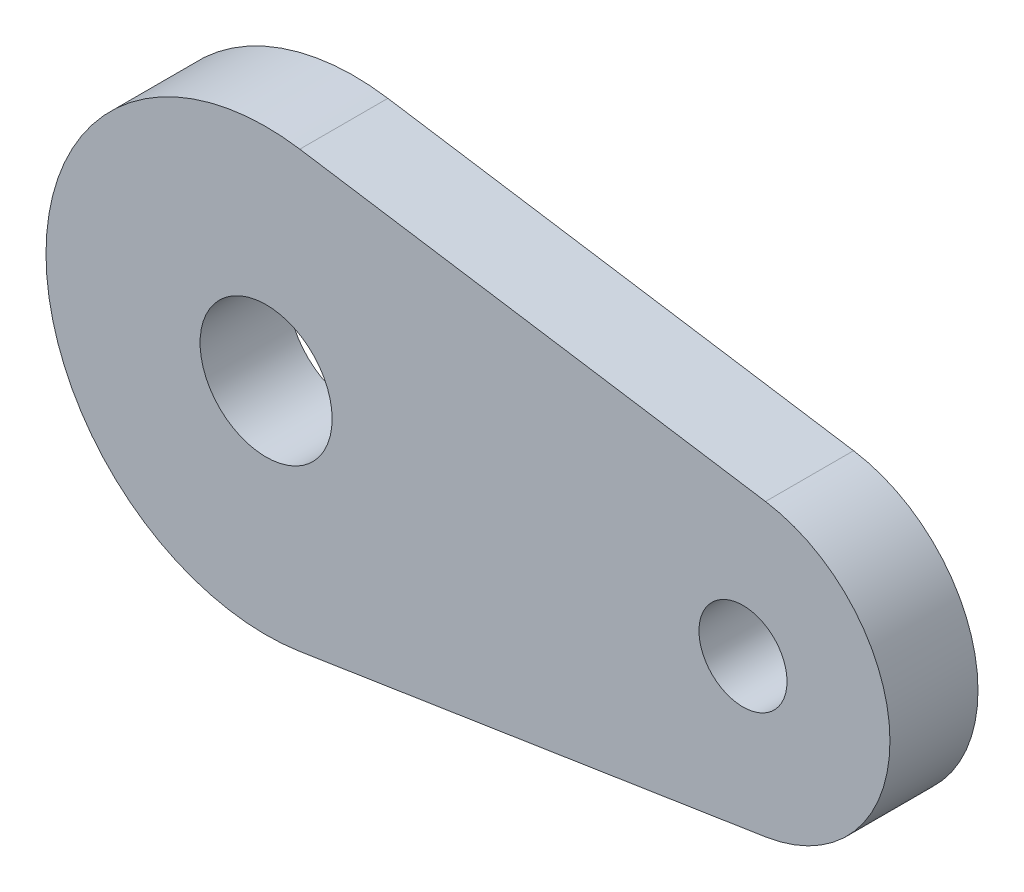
SolidWorks part; units mm, degrees
ref_plane "前视基准面" through (0, 0, 0) normal (0, 0, 1) x (1, 0, 0)
ref_plane "上视基准面" through (0, 0, 0) normal (0, 1, 0) x (1, 0, 0)
ref_plane "右视基准面" through (0, 0, 0) normal (1, 0, 0) x (0, 0, -1)
sketch "草图1" plane through (0, 0, 0) normal (0, 0, 1) x (1, 0, 0)
  line L0 (0, 0) -> (65, 0) construction
  line L1 (4.5963, 29.6458) -> (68.0721, 19.7941)
  line L2 (4.5963, -29.6458) -> (68.0721, -19.7941)
  arc A0 (4.5963, 29.6458) -> (4.5963, -29.6458) centre (0, 0) ccw
  circle A1 centre (0, 0) radius 9
  arc A2 (68.0721, -19.7941) -> (68.0721, 19.7941) centre (65, 0) ccw
  circle A3 centre (65, 0) radius 6
extrude "凸台-拉伸1" add sketch "草图1" along normal blind 12
